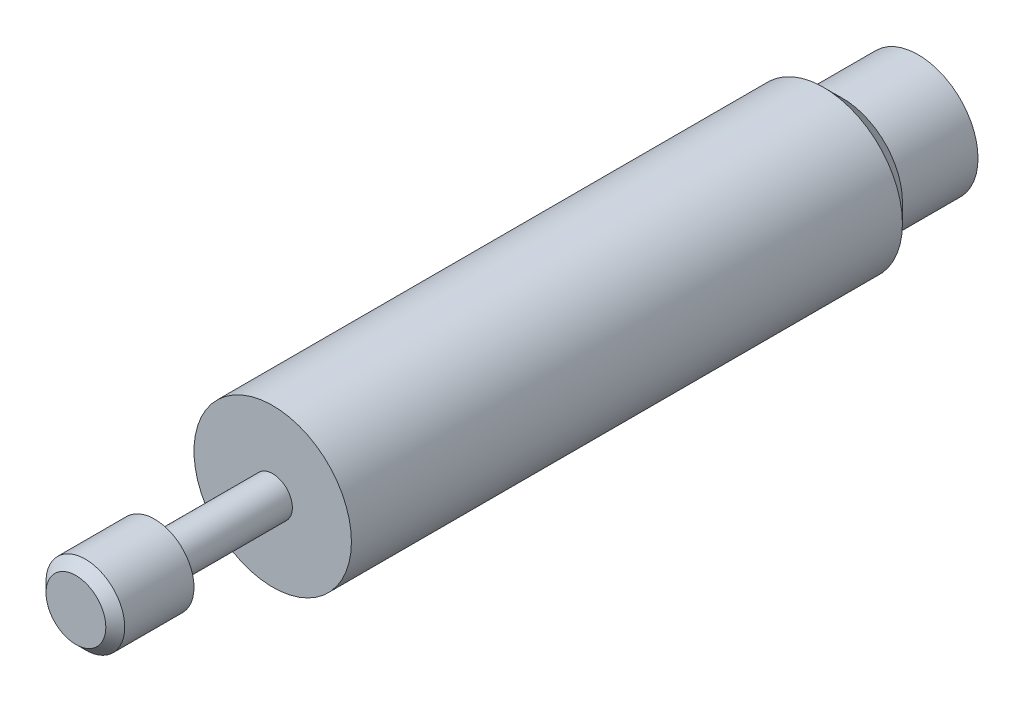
SolidWorks part; units mm, degrees
ref_plane "Front/Back" through (0, 0, 0) normal (0, 0, 1) x (1, 0, 0)
ref_plane "Top/Bottom" through (0, 0, 0) normal (0, 1, 0) x (1, 0, 0)
ref_plane "Right/Left" through (0, 0, 0) normal (1, 0, 0) x (0, 0, -1)
sketch "Sketch1" plane through (0, 0, 0) normal (0, 0, 1) x (1, 0, 0)
  circle A0 centre (0, 0) radius 6.35
  dimension "D1" = 12.7
extrude "Extrude1" add sketch "Sketch1" along normal mid plane 44.45
sketch "Sketch2" plane through (0, 0, -22.225) normal (0, 0, -1) x (-1, 0, 0)
  circle A0 centre (0, 0) radius 4.826
  dimension "D1" = 9.652
extrude "Extrude2" add sketch "Sketch2" along normal blind 7.62
chamfer "Chamfer1" distance 1.524 angle 45 1 edges at (4.826, 0, -22.225)
sketch "Sketch3" plane through (0, 0, 22.225) normal (0, 0, 1) x (1, 0, 0)
  circle A0 centre (0, 0) radius 1.5875
  dimension "D1" = 3.175
extrude "Extrude3" add sketch "Sketch3" along normal blind 9.525
sketch "Sketch5" plane through (0, 0, 31.75) normal (0, 0, 1) x (1, 0, 0)
  circle A0 centre (0, 0) radius 3.175
  dimension "D1" = 6.35
extrude "Extrude4" add sketch "Sketch5" along normal blind 6.35
chamfer "Chamfer2" distance 0.762 angle 45 1 edges at (3.175, 0, 38.1)
